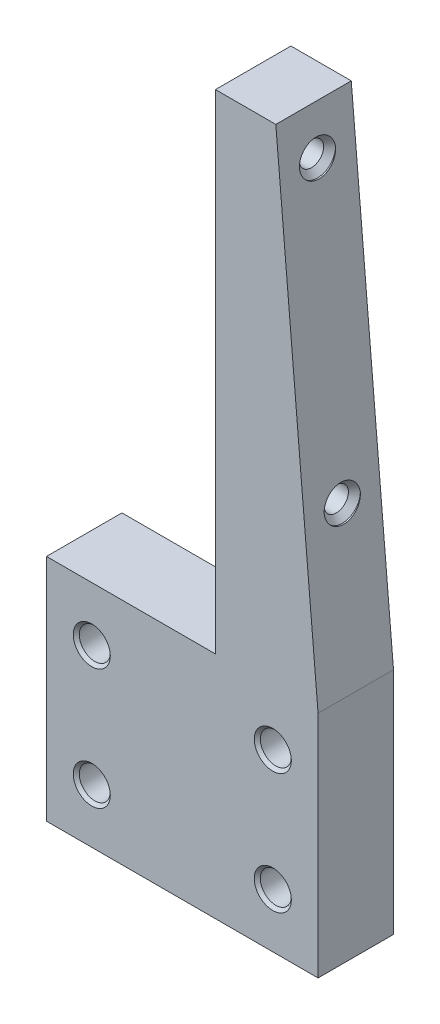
SolidWorks part; units mm, degrees
ref_plane "Front Plane" through (0, 0, 0) normal (0, 0, 1) x (1, 0, 0)
ref_plane "Top Plane" through (0, 0, 0) normal (0, 1, 0) x (1, 0, 0)
ref_plane "Right Plane" through (0, 0, 0) normal (1, 0, 0) x (0, 0, -1)
sketch "Sketch1" plane through (0, 0, 0) normal (0, 0, 1) x (1, 0, 0)
  line L0 (0, -1.27) -> (-35.56, -1.27)
  line L1 (-35.56, -1.27) -> (-35.56, -49.53)
  line L2 (-35.56, -49.53) -> (21.59, -49.53)
  line L3 (21.59, -49.53) -> (21.59, -1.27)
  line L4 (21.59, -1.27) -> (12.7, 101.6)
  line L5 (12.7, 101.6) -> (0, 101.6)
  line L6 (0, 101.6) -> (0, -1.27)
  line L7 (0, 0) -> (12.7, 0) construction
  dimension "D1" = 35.56
  dimension "D2" = 57.15
  dimension "D3" = 101.6
  dimension "D4" = 12.7
  dimension "D5" = 48.26
  dimension "D6" = 1.27
extrude "Boss-Extrude1" add sketch "Sketch1" along normal mid plane 15.875
sketch "Sketch2" plane through (0, 0, 7.9375) normal (0, 0, 1) x (1, 0, 0)
  line L0 (-35.56, -25.4) -> (-22.3583, -25.4) construction
  line L1 (-35.56, -1.27) -> (-35.56, -49.53) construction
  line L2 (-6.985, -49.53) -> (-6.985, -36.4978) construction
  line L3 (-35.56, -49.53) -> (21.59, -49.53) construction
  line L5 (-26.035, -12.7) -> (12.065, -12.7)
  line L6 (-26.035, -12.7) -> (-26.035, -38.1)
  line L7 (-26.035, -38.1) -> (12.065, -38.1)
  line L8 (12.065, -12.7) -> (12.065, -38.1)
  point P12 (-6.985, -38.1)
  point P13 (-26.035, -25.4)
  dimension "D1" = 25.4
  dimension "D2" = 38.1
hole_wizard "1/4 Clearance Hole1" positions "Sketch4" profile "Sketch3" hole size "1/4" standard "Ansi Inch"
sketch "Sketch4" plane through (0, 0, 7.9375) normal (0, 0, 1) x (1, 0, 0)
  point P0 (-26.035, -12.7)
  point P2 (12.065, -12.7)
  point P5 (12.065, -38.1)
  point P8 (-26.035, -38.1)
sketch "Sketch3" plane through (-26.035, -12.7, 7.9375) normal (1, 0, 0) x (0, -1, 0)
  line L0 (0, 0) -> (0, 15.875)
  line L1 (0, 15.875) -> (3.8989, 15.875)
  line L2 (3.2639, 15.24) -> (3.2639, 0.635)
  line L3 (3.2639, 0.635) -> (3.8989, 0)
  line L5 (3.8989, 0) -> (0, 0)
  line L6 (-3.2639, 0.635) -> (-3.8989, 0) construction
  line L7 (3.8989, 15.875) -> (3.2639, 15.24)
  line L8 (-3.8989, 15.875) -> (-3.2639, 15.24) construction
  line L11 (0, -6.35) -> (0, 107.95) construction
  dimension "Thru Hole Dia." = 6.5278
  dimension "Thru Hole Depth" = 15.875
  dimension "Near C'Sink Dia." = 7.7978
  dimension "Near C'Sink Angle" = 90
  dimension "Far C'Sink Dia." = 7.7978
  dimension "Far C'Sink Angle" = 90
sketch "Sketch5" plane through (0, 0, 0) normal (-1, 0, 0) x (0, 0, 1)
  line L0 (0, 92.075) -> (0, 31.75) construction
  dimension "D1" = 31.75
  dimension "D2" = 60.325
hole_wizard "1/4-20 Tapped Hole1" positions "Sketch7" profile "Sketch6" tap size "1/4-20" standard "Ansi Inch"
sketch "Sketch7" plane through (0, 0, 0) normal (-1, 0, 0) x (0, 0, 1)
  point P0 (0, 92.075)
  point P1 (0, 31.75)
sketch "Sketch6" plane through (0, 92.075, 0) normal (0, 1, 0) x (0, 0, 1)
  line L0 (0, 0) -> (0, 13.5231)
  line L1 (0, 13.5231) -> (3.81, 13.5231)
  line L2 (2.5527, 12.2658) -> (2.5527, 1.2573)
  line L3 (2.5527, 1.2573) -> (3.81, 0)
  line L5 (3.81, 0) -> (0, 0)
  line L6 (-2.5527, 1.2573) -> (-3.81, 0) construction
  line L7 (3.81, 13.5231) -> (2.5527, 12.2658)
  line L8 (-3.81, 13.5231) -> (-2.5527, 12.2658) construction
  line L11 (0, -6.35) -> (0, 107.95) construction
  dimension "Thru Tap Drill Dia." = 5.1054
  dimension "Thru Tap Drill Depth" = 13.5231
  dimension "Near C'Sink Dia." = 7.62
  dimension "Near C'Sink Angle" = 90
  dimension "Far C'Sink Dia." = 7.62
  dimension "Far C'Sink Angle" = 90
